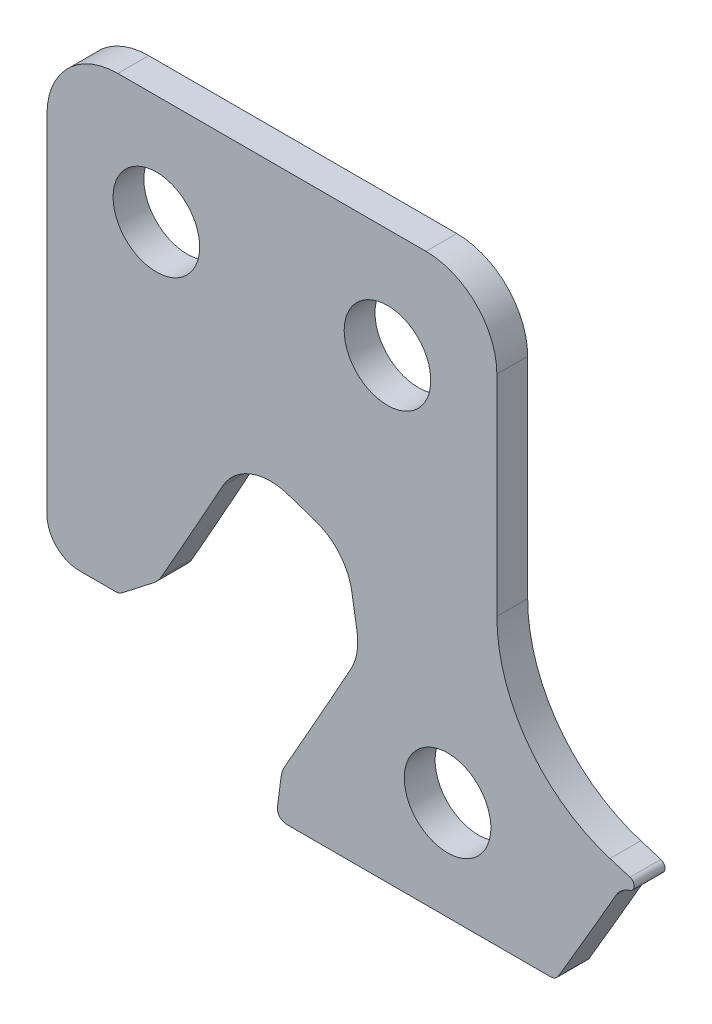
SolidWorks part; units mm, degrees
ref_plane "Front" through (0, 0, 0) normal (0, 0, 1) x (1, 0, 0)
ref_plane "Top" through (0, 0, 0) normal (0, 1, 0) x (1, 0, 0)
ref_plane "Right" through (0, 0, 0) normal (1, 0, 0) x (0, 0, -1)
sketch "Sketch1" plane through (0, 0, 0) normal (0, 0, 1) x (1, 0, 0)
  line L20 (-959.3046, 67.7453) -> (-960.9557, 68.2533)
  line L21 (-970.28, 80.8774) -> (-970.28, 98.171)
  line L22 (-976.122, 104.013) -> (-1001.522, 104.013)
  line L23 (-1007.364, 98.171) -> (-1007.364, 69.596)
  line L24 (-1004.697, 66.929) -> (-1001.6626, 66.929)
  line L25 (-1001.1938, 67.0902) -> (-998.568, 69.1392)
  line L26 (-987.5232, 80.9743) -> (-985.2669, 80.2253)
  line L27 (-982.2389, 76.6785) -> (-981.8033, 74.0301)
  line L28 (-988.0716, 60.4998) -> (-988.3671, 58.2214)
  line L29 (-987.6114, 57.3615) -> (-965.8621, 57.3615)
  line L30 (-959.3046, 67.7453) -> (-960.9557, 68.2533)
  line L31 (-970.28, 80.8774) -> (-970.28, 98.171)
  line L32 (-976.122, 104.013) -> (-1001.522, 104.013)
  line L33 (-1007.364, 98.171) -> (-1007.364, 69.596)
  line L34 (-1004.697, 66.929) -> (-1001.6626, 66.929)
  line L35 (-1001.1938, 67.0902) -> (-998.568, 69.1392)
  line L36 (-987.5232, 80.9743) -> (-985.2669, 80.2253)
  line L37 (-982.2389, 76.6785) -> (-981.8033, 74.0301)
  line L38 (-988.0716, 60.4998) -> (-988.3671, 58.2214)
  line L39 (-987.6114, 57.3615) -> (-965.8621, 57.3615)
  arc A34 (-965.8621, 57.3615) -> (-965.2058, 57.7362) centre (-965.8621, 58.1235) ccw
  arc A35 (-965.2058, 57.7362) -> (-960.4626, 65.8776) centre (-1693.6675, 487.596) ccw
  arc A36 (-959.3034, 66.8052) -> (-960.4626, 65.8776) centre (-958.7011, 64.8645) ccw
  arc A37 (-959.3034, 66.8052) -> (-959.3046, 67.7453) centre (-959.4493, 67.2751) ccw
  arc A38 (-970.28, 80.8774) -> (-960.9557, 68.2533) centre (-957.072, 80.8774) ccw
  arc A39 (-970.28, 98.171) -> (-976.122, 104.013) centre (-976.122, 98.171) ccw
  arc A40 (-1001.522, 104.013) -> (-1007.364, 98.171) centre (-1001.522, 98.171) ccw
  arc A41 (-1007.364, 69.596) -> (-1004.697, 66.929) centre (-1004.697, 69.596) ccw
  arc A42 (-1001.6626, 66.929) -> (-1001.1938, 67.0902) centre (-1001.6626, 67.691) ccw
  arc A43 (-998.568, 69.1392) -> (-997.9218, 69.8873) centre (-1000.1305, 71.1417) ccw
  arc A44 (-997.9218, 69.8873) -> (-992.8901, 78.8741) centre (-1733.4185, 487.596) ccw
  arc A45 (-987.5232, 80.9743) -> (-992.8901, 78.8741) centre (-988.9433, 76.6958) ccw
  arc A46 (-982.2389, 76.6785) -> (-985.2669, 80.2253) centre (-986.6871, 75.9469) ccw
  arc A47 (-982.309, 71.1124) -> (-981.8033, 74.0301) centre (-986.2515, 73.2984) ccw
  arc A48 (-987.758, 61.4336) -> (-982.309, 71.1124) centre (-1733.4185, 487.596) ccw
  arc A49 (-987.758, 61.4336) -> (-988.0716, 60.4998) centre (-985.5527, 60.1732) ccw
  arc A50 (-988.3671, 58.2214) -> (-987.6114, 57.3615) centre (-987.6114, 58.1235) ccw
  arc A51 (-965.8621, 57.3615) -> (-965.2058, 57.7362) centre (-965.8621, 58.1235) ccw
  arc A52 (-965.2058, 57.7362) -> (-960.4626, 65.8776) centre (-1693.6675, 487.596) ccw
  arc A53 (-959.3034, 66.8052) -> (-960.4626, 65.8776) centre (-958.7011, 64.8645) ccw
  arc A54 (-959.3034, 66.8052) -> (-959.3046, 67.7453) centre (-959.4493, 67.2751) ccw
  arc A55 (-970.28, 80.8774) -> (-960.9557, 68.2533) centre (-957.072, 80.8774) ccw
  arc A56 (-970.28, 98.171) -> (-976.122, 104.013) centre (-976.122, 98.171) ccw
  arc A57 (-1001.522, 104.013) -> (-1007.364, 98.171) centre (-1001.522, 98.171) ccw
  arc A58 (-1007.364, 69.596) -> (-1004.697, 66.929) centre (-1004.697, 69.596) ccw
  arc A59 (-1001.6626, 66.929) -> (-1001.1938, 67.0902) centre (-1001.6626, 67.691) ccw
  arc A60 (-998.568, 69.1392) -> (-997.9218, 69.8873) centre (-1000.1305, 71.1417) ccw
  arc A61 (-997.9218, 69.8873) -> (-992.8901, 78.8741) centre (-1733.4185, 487.596) ccw
  arc A62 (-987.5232, 80.9743) -> (-992.8901, 78.8741) centre (-988.9433, 76.6958) ccw
  arc A63 (-982.2389, 76.6785) -> (-985.2669, 80.2253) centre (-986.6871, 75.9469) ccw
  arc A64 (-982.309, 71.1124) -> (-981.8033, 74.0301) centre (-986.2515, 73.2984) ccw
  arc A65 (-987.758, 61.4336) -> (-982.309, 71.1124) centre (-1733.4185, 487.596) ccw
  arc A66 (-987.758, 61.4336) -> (-988.0716, 60.4998) centre (-985.5527, 60.1732) ccw
  arc A67 (-988.3671, 58.2214) -> (-987.6114, 57.3615) centre (-987.6114, 58.1235) ccw
  dimension "D1" = 0.508
extrude "Boss-Extrude1" add sketch "Sketch1" against normal blind 2.54 separate body
hole_wizard "Hole1" positions "Point_Sketch" profile "Profil_Sketch" hole size "Ø0.15" standard "ISO"
sketch "Point_Sketch" plane through (-970.6897, 76.1331, -2.54) normal (0, 0, 1) x (-1, 0, 0)
  point P0 (3.6543, 10.6011)
  point P2 (8.6073, -18.8629)
  point P4 (27.6573, -18.8629)
sketch "Profil_Sketch" plane through (-974.344, 65.532, -2.54) normal (1, 0, 0) x (0, 1, 0)
  line L0 (0, 0) -> (0, 2.54)
  line L1 (0, 2.54) -> (3.5687, 2.54)
  line L2 (3.5687, 2.54) -> (3.5687, 0)
  line L5 (3.5687, 0) -> (0, 0)
  line L11 (0, -6.35) -> (0, 107.95) construction
  dimension "Diameter" = 7.1374
  dimension "Thru Hole Depth" = 2.54
other "usin_DL090_.25-20x3-SHCS<1>"
